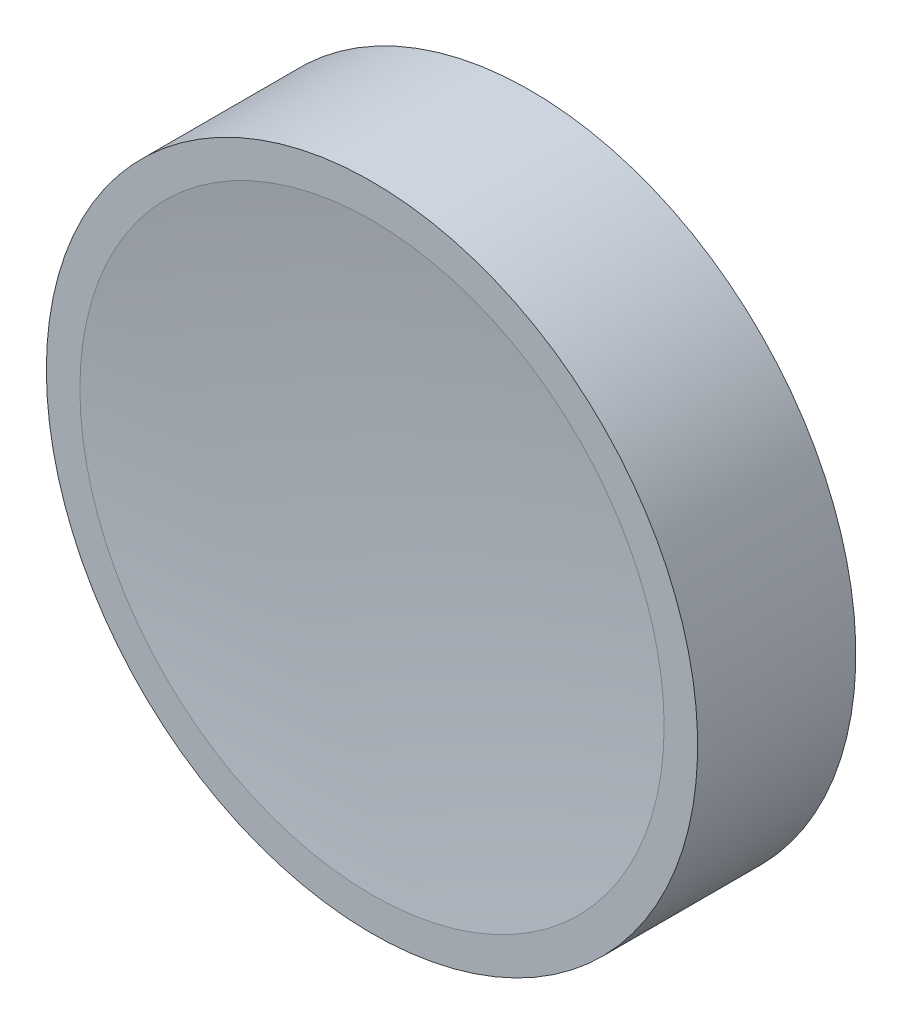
SolidWorks part; units mm, degrees
ref_plane "Front Plane" through (0, 0, 0) normal (0, 0, 1) x (1, 0, 0)
ref_plane "Top Plane" through (0, 0, 0) normal (0, 1, 0) x (1, 0, 0)
ref_plane "Right Plane" through (0, 0, 0) normal (1, 0, 0) x (0, 0, -1)
sketch "Sketch1" plane through (0, 0, 0) normal (0, 0, 1) x (1, 0, 0)
  circle A0 centre (0, 0) radius 17
  dimension "D1" = 34
extrude "Boss-Extrude1" add sketch "Sketch1" along normal blind 9.6572
sketch "Sketch2" plane through (0, 0, 0) normal (0, 1, 0) x (1, 0, 0)
  line L0 (17, 0) -> (0, 0)
  line L1 (0, 0) -> (0, -5.5027)
  arc A0 (-17, 0) -> (17, 0) centre (0, 23.5083) ccw construction
  arc A1 (0, -5.5027) -> (17, 0) centre (0, 23.5083) ccw
  dimension "D1" = 29.011
revolve "Cut-Revolve1" cut sketch "Sketch2" angle 360 about L1
sketch "Sketch3" plane through (0, 0, 0) normal (0, 1, 0) x (1, 0, 0)
  line L0 (17, -9.6572) -> (0, -9.6572)
  line L1 (-17, -9.6572) -> (17, -9.6572) construction
  line L2 (0, -9.6572) -> (0, -8.4958)
  arc A0 (-17, -9.6572) -> (17, -9.6572) centre (0, -133.4918) cw construction
  arc A1 (0, -8.4958) -> (17, -9.6572) centre (0, -133.4918) cw
  dimension "D1" = 124.996
revolve "Cut-Revolve2" cut sketch "Sketch3" angle 360 about L2
ref_plane "Plane1" through (0, 0, 5.5027) normal (0, 0, -1) x (-1, 0, 0)
ref_plane "Plane2" through (0, 0, 8.4958) normal (0, 0, 1) x (1, 0, 0)
sketch "Sketch4" plane through (0, 0, 0) normal (0, 1, 0) x (1, 0, 0)
  line L0 (0, 0) -> (0, -50000) construction
  line L1 (-17, 0) -> (17, 0) construction
  line L2 (17, -9.6572) -> (-17, -9.6572) construction
  line L4 (-17, 0) -> (-15.25, 0)
  line L5 (-17, 0) -> (-17, -1.1712)
  line L6 (-17, -1.1712) -> (-15.25, -1.1712)
  line L7 (-15.25, 0) -> (-15.25, -1.1712)
  line L8 (-17, -9.6572) -> (-15.25, -9.6572)
  line L9 (-17, -9.6572) -> (-17, -9.4295)
  line L10 (-17, -9.4295) -> (-15.25, -9.4295)
  line L11 (-15.25, -9.6572) -> (-15.25, -9.4295)
  arc A0 (-17, 0) -> (17, 0) centre (0, 23.5083) ccw construction
  arc A1 (-17, -9.6572) -> (17, -9.6572) centre (0, -133.4918) cw construction
  dimension "D3" = 124.996
  dimension "D4" = 29.011
  dimension "D1" = 34
  dimension "D2" = 34
  dimension "D5" = 15.25
  dimension "D6" = 15.25
revolve "Cut-Revolve3" cut sketch "Sketch4" angle 360 about L0
